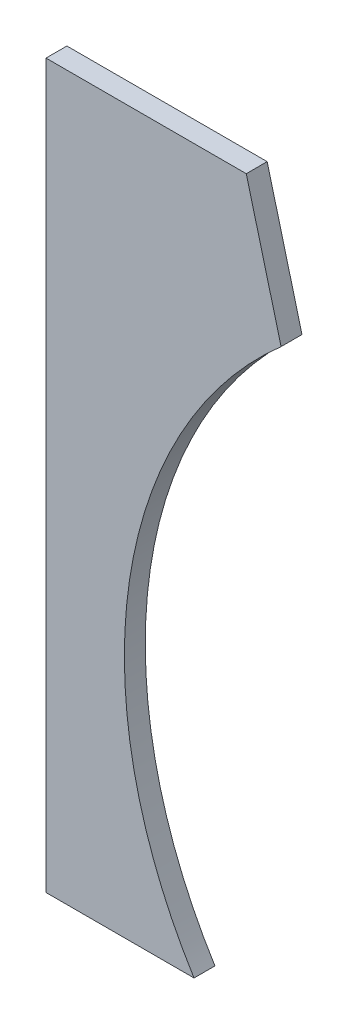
SolidWorks part; units mm, degrees
ref_plane "Plan de face" through (0, 0, 0) normal (0, 0, 1) x (1, 0, 0)
ref_plane "Plan de dessus" through (0, 0, 0) normal (0, 1, 0) x (1, 0, 0)
ref_plane "Plan de droite" through (0, 0, 0) normal (1, 0, 0) x (0, 0, -1)
sketch "Esquisse1" plane through (0, 0, 0) normal (0, 0, 1) x (1, 0, 0)
  line L0 (85, -140) -> (0, -140)
  line L1 (0, -140) -> (0, 275)
  line L2 (0, 275) -> (115, 275)
  line L3 (115, 275) -> (135, 198.9975)
  arc A0 (135, 198.9975) -> (85, -140) centre (310, 0) ccw
  dimension "D5" = 265
  dimension "D1" = 415
  dimension "D2" = 310
  dimension "D3" = 195
  dimension "D4" = 140
  dimension "D6" = 175
extrude "Extrusion1" add sketch "Esquisse1" along normal blind 12
